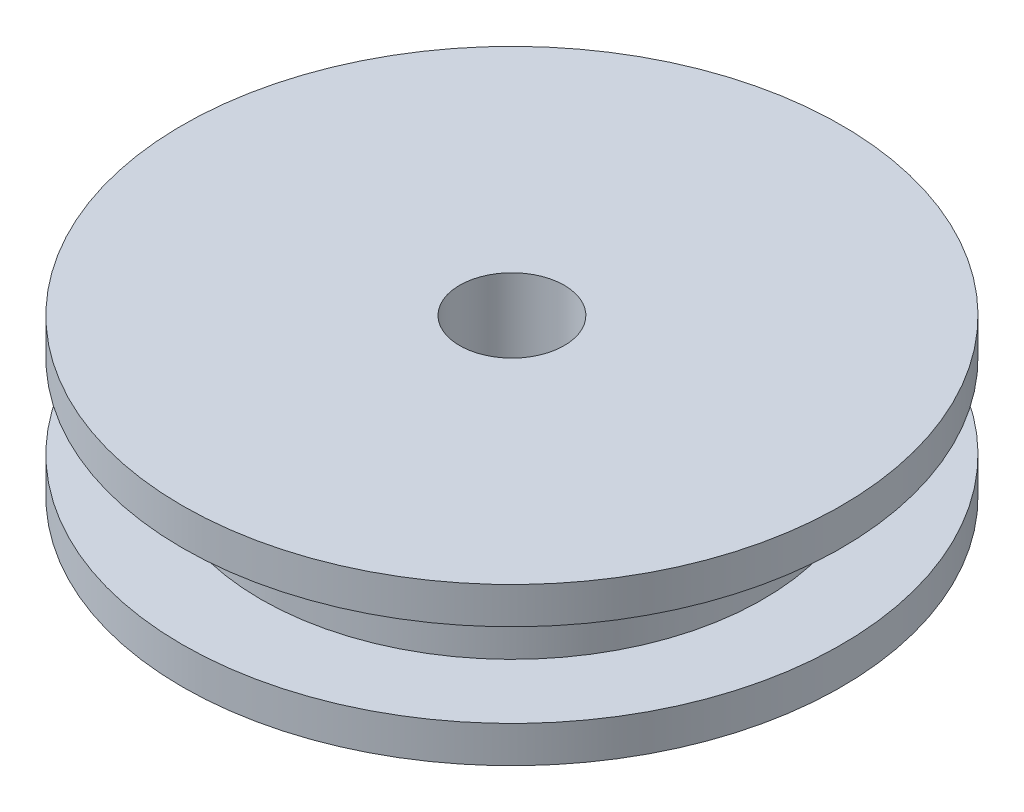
SolidWorks part; units mm, degrees
ref_plane "Plano frontal" through (0, 0, 0) normal (0, 0, 1) x (1, 0, 0)
ref_plane "Plano superior" through (0, 0, 0) normal (0, 1, 0) x (1, 0, 0)
ref_plane "Plano direito" through (0, 0, 0) normal (1, 0, 0) x (0, 0, -1)
sketch "Esboço1" plane through (0, 0, 0) normal (0, 1, 0) x (1, 0, 0)
  circle A0 centre (0, 0) radius 6.3
  dimension "D1" = 12.6
extrude "Ressalto-extrusão1" add sketch "Esboço1" along normal blind 0.7
sketch "Esboço10" plane through (0, 0.7, 0) normal (0, 1, 0) x (1, 0, 0)
  circle A0 centre (0, 0) radius 4.8
  dimension "D1" = 9.6
extrude "Ressalto-extrusão4" add sketch "Esboço10" along normal blind 1.6
sketch "Esboço11" plane through (0, 2.3, 0) normal (0, 1, 0) x (1, 0, 0)
  circle A0 centre (0, 0) radius 6.3
  dimension "D1" = 12.6
extrude "Ressalto-extrusão5" add sketch "Esboço11" along normal blind 0.7
sketch "Esboço12" plane through (0, 0, 0) normal (0, -1, 0) x (1, 0, 0)
  circle A0 centre (0, 0) radius 1
  dimension "D1" = 2
extrude "Corte-extrusão1" cut sketch "Esboço12" against normal up to next
sketch "Esboço13" plane through (0, 3, 0) normal (0, 1, 0) x (1, 0, 0)
  line L0 (-6.3, 0) -> (6.3, 0) construction
  circle A0 centre (0, 0) radius 6.3 construction
ref_plane "Plano1" through (0, 0, 0) normal (0, 0, 1) x (1, 0, 0)
sketch "Esboço14" [suppressed] plane through (0, 0, 0) normal (0, 0, 1) x (1, 0, 0)
  line L0 (-6.3, 2.25) -> (-5.65, 2.25)
  line L1 (-5, 1.6) -> (-5, 1.4)
  line L2 (-5.65, 0.75) -> (-6.3, 0.75)
  line L3 (-5.65, 2.25) -> (-5, 2.25)
  line L4 (-5, 2.25) -> (-5, 0.75)
  line L5 (-5, 0.75) -> (-5.65, 0.75)
  line L6 (0, 0) -> (0, 6.3916) construction
  arc A0 (-5, 1.4) -> (-5.65, 0.75) centre (-5.65, 1.4) cw
  arc A1 (-5, 1.6) -> (-5.65, 2.25) centre (-5.65, 1.6) ccw
  point P10 (-5, 0.75)
  point P13 (-5, 2.25)
  dimension "D1" = 0.65
